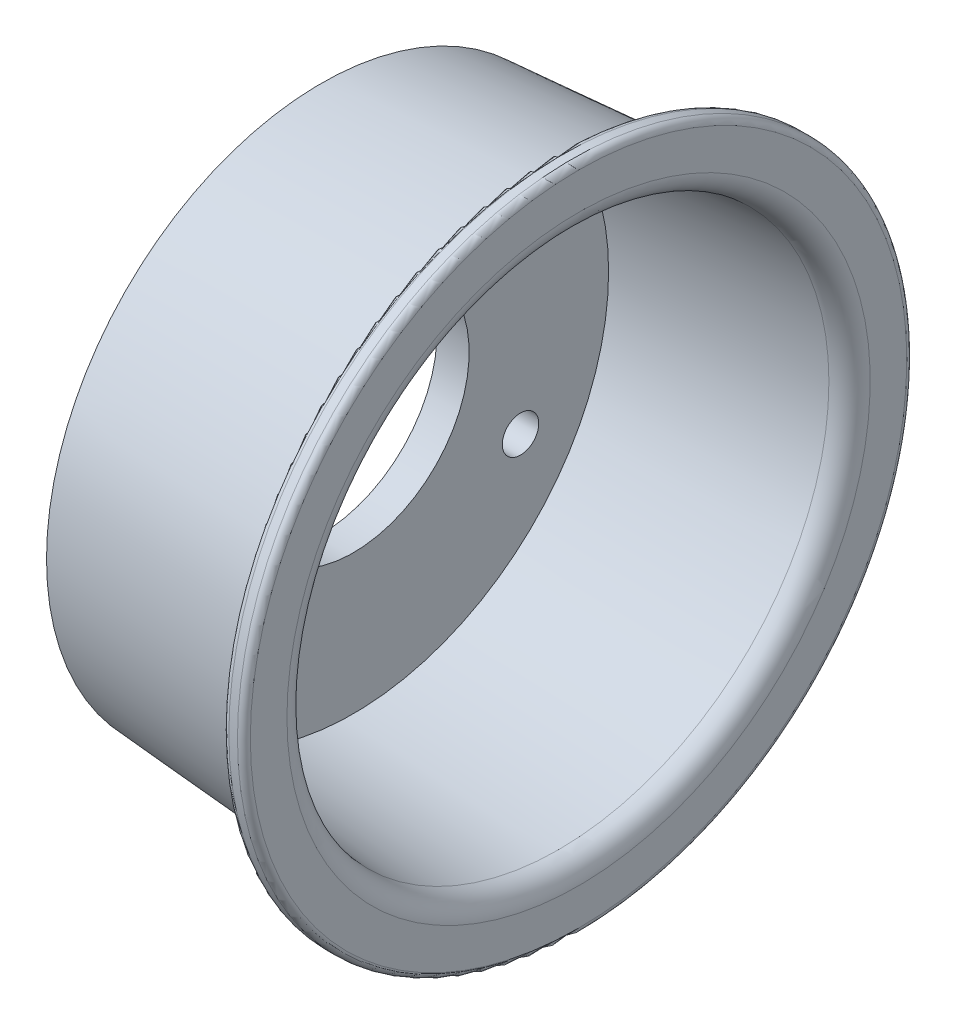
SolidWorks part; units mm, degrees
ref_plane "Plan1" through (0, 0, 0) normal (0, 0, 1) x (1, 0, 0)
ref_plane "Plan2" through (0, 0, 0) normal (0, 1, 0) x (1, 0, 0)
ref_plane "Plan3" through (0, 0, 0) normal (1, 0, 0) x (0, 0, -1)
sketch "Esquisse1" plane through (0, 0, 0) normal (0, 0, 1) x (1, 0, 0)
  line L0 (-25, -107) -> (-25, -43)
  line L1 (-25, -107) -> (-17.5, -107)
  line L2 (-17.5, -107) -> (-17.5, -47.5)
  line L3 (-25, -43) -> (30, -39)
  line L4 (-17.5, -47.5) -> (30.3627, -44.0191)
  line L5 (35, -39) -> (35, -39.0322)
  line L6 (35, -39) -> (35, -30.5)
  line L7 (-17.5, -107) -> (68.8215, -107) construction
  line L8 (33.5, -29) -> (31.5, -29)
  line L9 (30, -30.5) -> (30, -39)
  arc A0 (35, -39.0322) -> (30.3627, -44.0191) centre (30, -39.0322) cw
  arc A1 (35, -30.5) -> (33.5, -29) centre (33.5, -30.5) ccw
  arc A2 (30, -30.5) -> (31.5, -29) centre (31.5, -30.5) cw
  point P13 (35, -43.6818)
  point P16 (35, -29)
  point P19 (30, -29)
  dimension "D8" = 5
  dimension "D9" = 1.5
  dimension "D1" = 64
  dimension "D2" = 68
  dimension "D3" = 60
  dimension "D4" = 59.5
  dimension "D5" = 10
  dimension "D6" = 5
  dimension "D7" = 7.5
revolve "Base-Révolution" add sketch "Esquisse1" angle 360 about L7
sketch "Esquisse2" plane through (-25, 0, 0) normal (-1, 0, 0) x (0, 0, 1)
  circle A0 centre (0, -107) radius 27
  circle A1 centre (0, -107) radius 64 construction
  dimension "D1" = 54
extrude "Enlèv. mat.-Extru.1" cut sketch "Esquisse2" against normal through all
sketch "Esquisse3" plane through (-25, 0, 0) normal (-1, 0, 0) x (0, 0, 1)
  line L0 (0, -107) -> (0, -20) construction
  line L1 (0, -107) -> (-38.9711, -129.5) construction
  circle A0 centre (-38.9711, -129.5) radius 4.25
  dimension "D1" = 8.5
  dimension "D2" = 45
  dimension "D3" = 120
extrude "Enlèv. mat.-Extru.2" cut sketch "Esquisse3" against normal through all
pattern_circular "Répétition circulaire1" count 3 every 120
